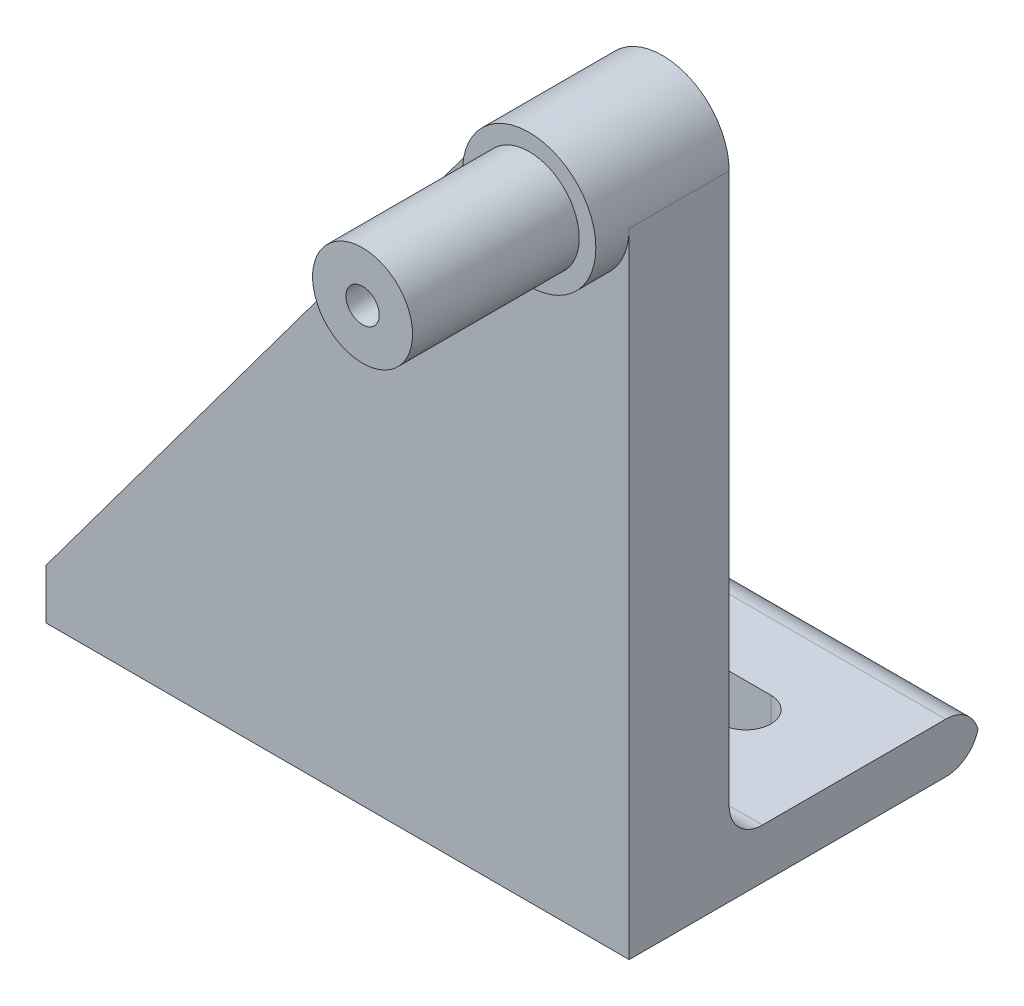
SolidWorks part; units mm, degrees
ref_plane "Plan de face" through (0, 0, 0) normal (0, 0, 1) x (1, 0, 0)
ref_plane "Plan de dessus" through (0, 0, 0) normal (0, 1, 0) x (1, 0, 0)
ref_plane "Plan de droite" through (0, 0, 0) normal (1, 0, 0) x (0, 0, -1)
sketch "Esquisse1" plane through (0, 0, 0) normal (0, 0, 1) x (1, 0, 0)
  line L0 (-35, 0) -> (0, 0)
  line L1 (0, 0) -> (0, 35)
  line L2 (-7.2103, 37.3862) -> (-35, 0)
  line L3 (-35, 0) -> (-35, -3)
  line L4 (-35, -3) -> (0, -3)
  line L5 (0, -3) -> (0, 0)
  line L6 (-35, -3) -> (-35, 0)
  line L7 (0, -3) -> (0, 0)
  arc A0 (0, 35) -> (-7.2103, 37.3862) centre (-4, 35) ccw
  dimension "D3" = 4
  dimension "D1" = 3
  dimension "D2" = 35
  dimension "D4" = 35
extrude "Boss.-Extru.1" add sketch "Esquisse1" along normal blind 6 contours L1 A0 L2 L0 | L4 L5 L0 L3
sketch "Esquisse2" plane through (0, 0, 6) normal (0, 0, 1) x (1, 0, 0)
  circle A0 centre (-4, 35) radius 4
  dimension "D1" = 8
extrude "Boss.-Extru.2" add sketch "Esquisse2" along normal blind 2
sketch "Esquisse3" plane through (0, 0, 8) normal (0, 0, 1) x (1, 0, 0)
  circle A0 centre (-4, 35) radius 3
  dimension "D1" = 6
extrude "Boss.-Extru.3" add sketch "Esquisse3" along normal blind 10
sketch "Esquisse4" plane through (0, 0, 0) normal (0, 0, -1) x (-1, 0, 0)
  line L1 (0, -3) -> (35, -3)
  line L2 (0, -3) -> (0, 0)
  line L3 (0, 0) -> (35, 0)
  line L4 (35, -3) -> (35, 0)
extrude "Boss.-Extru.4" add sketch "Esquisse4" along normal blind 15
sketch "Esquisse5" plane through (0, 0, 18) normal (0, 0, 1) x (1, 0, 0)
  circle A0 centre (-4, 35) radius 1
  dimension "D1" = 2
extrude "Enlèv. mat.-Extru.1" cut sketch "Esquisse5" against normal blind 32
fillet "Congé1" radius 2 3 edges at (-17.5, -3, -15) (-17.5, 0, -15) (-17.5, 0, 0)
sketch "Esquisse6" plane through (0, 0, 0) normal (0, 1, 0) x (1, 0, 0)
  line L0 (-35, 7.5) -> (0, 7.5) construction
  line L1 (-35, 13) -> (-35, 2) construction
  line L2 (0, 13) -> (0, 2) construction
  line L3 (-28.5, 7.5) -> (-6.5, 7.5) construction
  line L4 (-28.5, 9) -> (-6.5, 9)
  line L5 (-28.5, 6) -> (-6.5, 6)
  arc A0 (-28.5, 9) -> (-28.5, 6) centre (-28.5, 7.5) ccw
  arc A1 (-6.5, 6) -> (-6.5, 9) centre (-6.5, 7.5) ccw
  point P8 (-17.5, 7.5)
  point P13 (0, 0)
  point P14 (-17.5, 7.5)
  dimension "D2" = 22
  dimension "D1" = 3
extrude "Enlèv. mat.-Extru.2" cut sketch "Esquisse6" against normal blind 32
